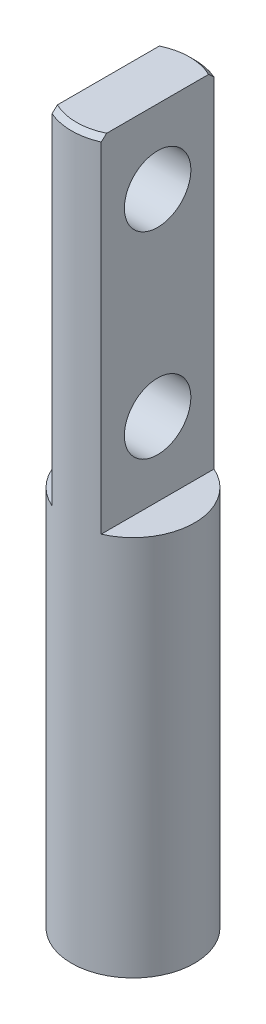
SolidWorks part; units mm, degrees
ref_plane "Front Plane" through (0, 0, 0) normal (0, 0, 1) x (1, 0, 0)
ref_plane "Top Plane" through (0, 0, 0) normal (0, 1, 0) x (1, 0, 0)
ref_plane "Right Plane" through (0, 0, 0) normal (1, 0, 0) x (0, 0, -1)
sketch "Sketch1" plane through (0, 0, 0) normal (0, 1, 0) x (1, 0, 0)
  circle A0 centre (0, 0) radius 2.5
  dimension "D1" = 5
extrude "Boss-Extrude1" add sketch "Sketch1" along normal blind 15.5
sketch "Sketch3" plane through (0, 15.5, 0) normal (0, 1, 0) x (1, 0, 0)
  line L0 (0, 0) -> (0, 2.6699) construction
  line L1 (1, -2.2913) -> (1, 2.2913)
  line L2 (-1, -2.2913) -> (-1, 2.2913)
  line L3 (-1, 0) -> (-1, 2.6699) construction
  line L4 (1, 0) -> (1, 2.6699) construction
  arc A1 (-1, -2.2913) -> (1, -2.2913) centre (0, 0) ccw
  arc A2 (1, 2.2913) -> (-1, 2.2913) centre (0, 0) ccw
  dimension "D3" = 2.5
  dimension "D1" = 1
  dimension "D2" = 1
extrude "Boss-Extrude2" add sketch "Sketch3" along normal blind 14
sketch "Sketch4" plane through (-1, 0, 0) normal (-1, 0, 0) x (0, 0, 1)
  line L1 (-2.2913, 29.5) -> (2.2913, 29.5) construction
  line L4 (0, 29.5) -> (0, 15.5) construction
  circle A0 centre (0, 26.5) radius 1.35
  circle A1 centre (0, 18.5) radius 1.35
  dimension "D1" = 2.7
  dimension "D2" = 8
  dimension "D3" = 3
extrude "Cut-Extrude2" cut sketch "Sketch4" against normal blind 2
chamfer "Chamfer1" distance 0.2 angle 45 2 edges at (0, 29.5, -2.5) (0, 29.5, 2.5)
